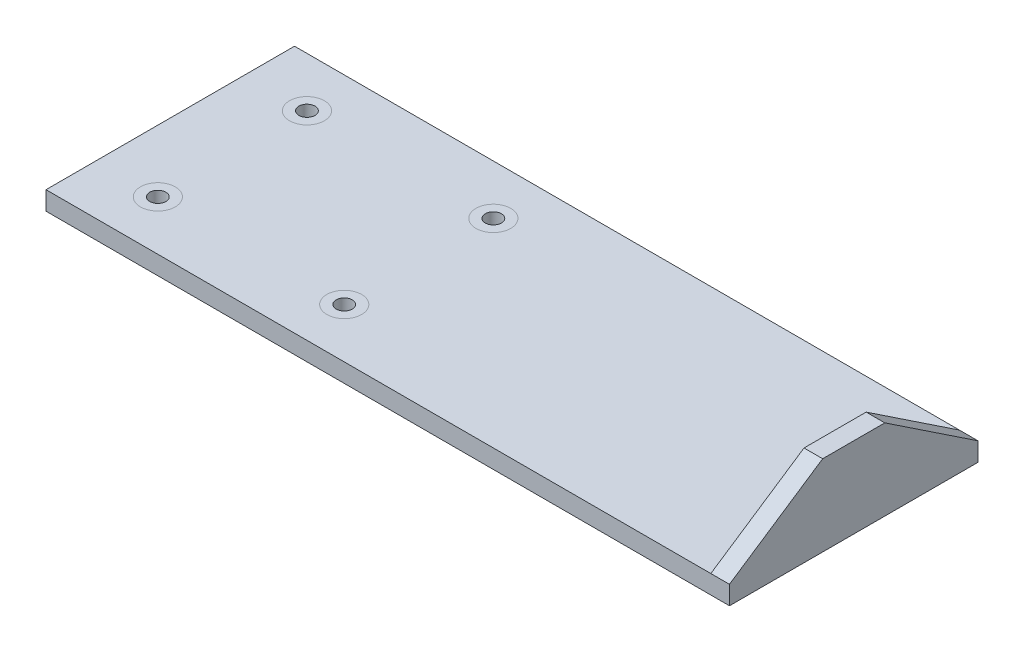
SolidWorks part; units mm, degrees
ref_plane "Front Plane" through (0, 0, 0) normal (0, 0, 1) x (1, 0, 0)
ref_plane "Top Plane" through (0, 0, 0) normal (0, 1, 0) x (1, 0, 0)
ref_plane "Right Plane" through (0, 0, 0) normal (1, 0, 0) x (0, 0, -1)
sketch "Sketch1" plane through (0, 0, 0) normal (0, 1, 0) x (1, 0, 0)
  line L1 (0, 100) -> (550, 100)
  line L2 (0, 100) -> (0, -100)
  line L3 (0, -100) -> (550, -100)
  line L4 (550, 100) -> (550, -100)
  dimension "D1" = 550
  dimension "D2" = 200
  dimension "D3" = 100
extrude "Extrude1" add sketch "Sketch1" against normal blind 15
sketch "Sketch3" plane through (0, 0, 0) normal (0, 1, 0) x (-1, 0, 0)
  line L0 (0, 100) -> (-550, 100) construction
  line L1 (-550, -100) -> (-535, -100)
  line L2 (-550, -100) -> (-550, 100)
  line L3 (-550, 100) -> (-535, 100)
  line L4 (-535, -100) -> (-535, 100)
  dimension "D1" = 15
extrude "Extrude2" add sketch "Sketch3" along normal blind 50
sketch "Sketch4" plane through (535, 0, 0) normal (-1, 0, 0) x (0, 0, 1)
  line L0 (100, 0) -> (25, 50)
  line L1 (-100, 50) -> (100, 50) construction
  line L2 (-100, 0) -> (-25, 50)
  dimension "D1" = 75
  dimension "D2" = 75
extrude "Cut-Extrude3" cut sketch "Sketch4" against normal through all and the other way through all contours L2
sketch "Sketch7" plane through (535, 0, 0) normal (-1, 0, 0) x (0, 0, 1)
  line L0 (100, 0) -> (25, 50)
  line L1 (-25, 50) -> (100, 50) construction
  dimension "D1" = 75
extrude "Cut-Extrude4" cut sketch "Sketch7" against normal through all and the other way through all flip side to cut
ref_plane "Plane2" through (250, 0, 0) normal (-1, 0, 0) x (0, 0, 1)
sketch "Sketch8" plane through (0, 0, 0) normal (0, 1, 0) x (-1, 0, 0)
  line L0 (0, -100) -> (0, 100) construction
  circle A0 centre (-50, -60) radius 6.5
  circle A1 centre (-200, -60) radius 6.5
  circle A2 centre (-50, 60) radius 6.5
  circle A3 centre (-200, 60) radius 6.5
  dimension "D9" = 13
  dimension "D10" = 13
  dimension "D11" = 13
  dimension "D12" = 13
  dimension "D1" = 50
  dimension "D2" = 50
  dimension "D3" = 200
  dimension "D4" = 200
  dimension "D5" = 60
  dimension "D6" = 60
  dimension "D7" = 60
  dimension "D8" = 60
extrude "Cut-Extrude5" cut sketch "Sketch8" against normal through all
ref_plane "Plane3" through (0, 250, 0) normal (0, 1, 0) x (-1, 0, 0)
sketch "Sketch9" plane through (0, 250, 0) normal (0, 1, 0) x (-1, 0, 0)
  circle A0 centre (-50, -60) radius 14
  dimension "D1" = 28
sketch "Sketch10" plane through (0, 250, 0) normal (0, 1, 0) x (-1, 0, 0)
  circle A0 centre (-200, -60) radius 14
  dimension "D1" = 28
sketch "Sketch11" plane through (0, 250, 0) normal (0, 1, 0) x (-1, 0, 0)
  circle A0 centre (-50, 60) radius 14
  dimension "D1" = 28
sketch "Sketch12" plane through (0, 250, 0) normal (0, 1, 0) x (-1, 0, 0)
  circle A0 centre (-200, 60) radius 14
  dimension "D1" = 28
